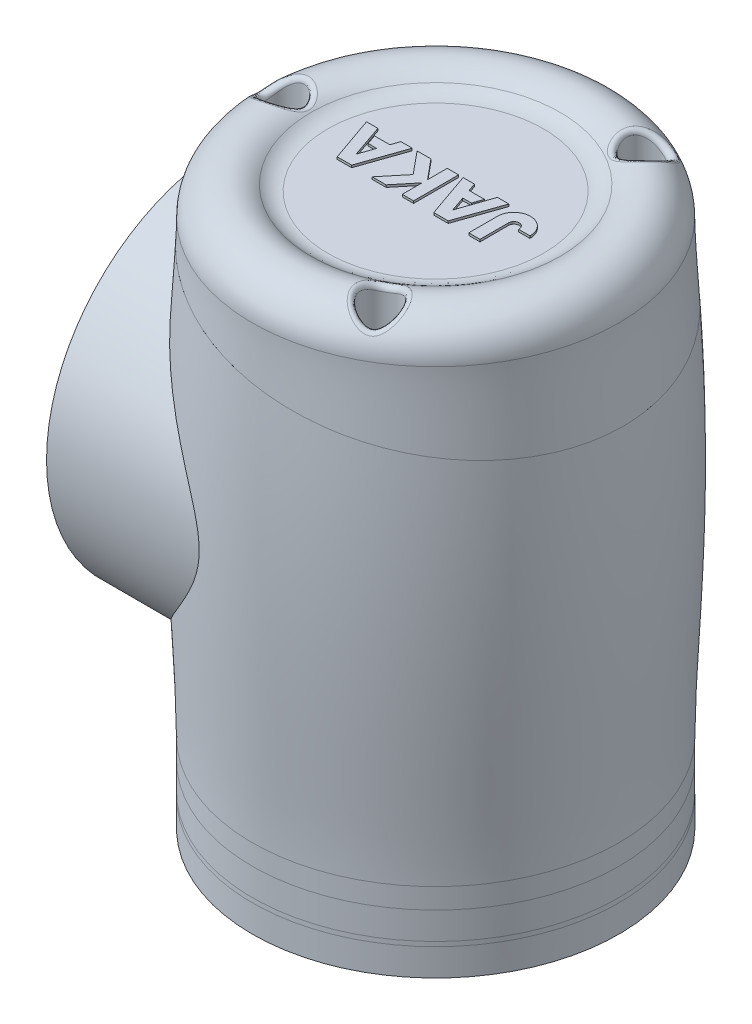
SolidWorks part; units mm, degrees
ref_plane "前视基准面" through (0, 0, 0) normal (0, 0, 1) x (1, 0, 0)
ref_plane "上视基准面" through (0, 0, 0) normal (0, 1, 0) x (1, 0, 0)
ref_plane "右视基准面" through (0, 0, 0) normal (1, 0, 0) x (0, 0, -1)
imported_body "01"
imported_body "02"
ref_plane "Plane1" through (0, 112.5, 0) normal (0, 1, 0) x (1, 0, 0)
sketch "Sketch1" plane through (0, 112.5, 0) normal (0, 1, 0) x (1, 0, 0)
  circle A0 centre (-33.5, 0) radius 4
  circle A1 centre (0, 0) radius 23.8397 construction
  circle A2 centre (16.75, 29.0119) radius 4
  circle A3 centre (16.75, -29.0119) radius 4
  point P10 (0, 0)
  dimension "D1" = 8
  dimension "D2" = 33.5
  dimension "D3" = 3
extrude "Extrude1" cut sketch "Sketch1" along normal through all
fillet "Fillet1" radius 1 3 edges at (19.403, 123.3023, 32.0054) (19.1259, 124.9905, -25.7939) (-30.5123, 124.7779, 2.6596)
